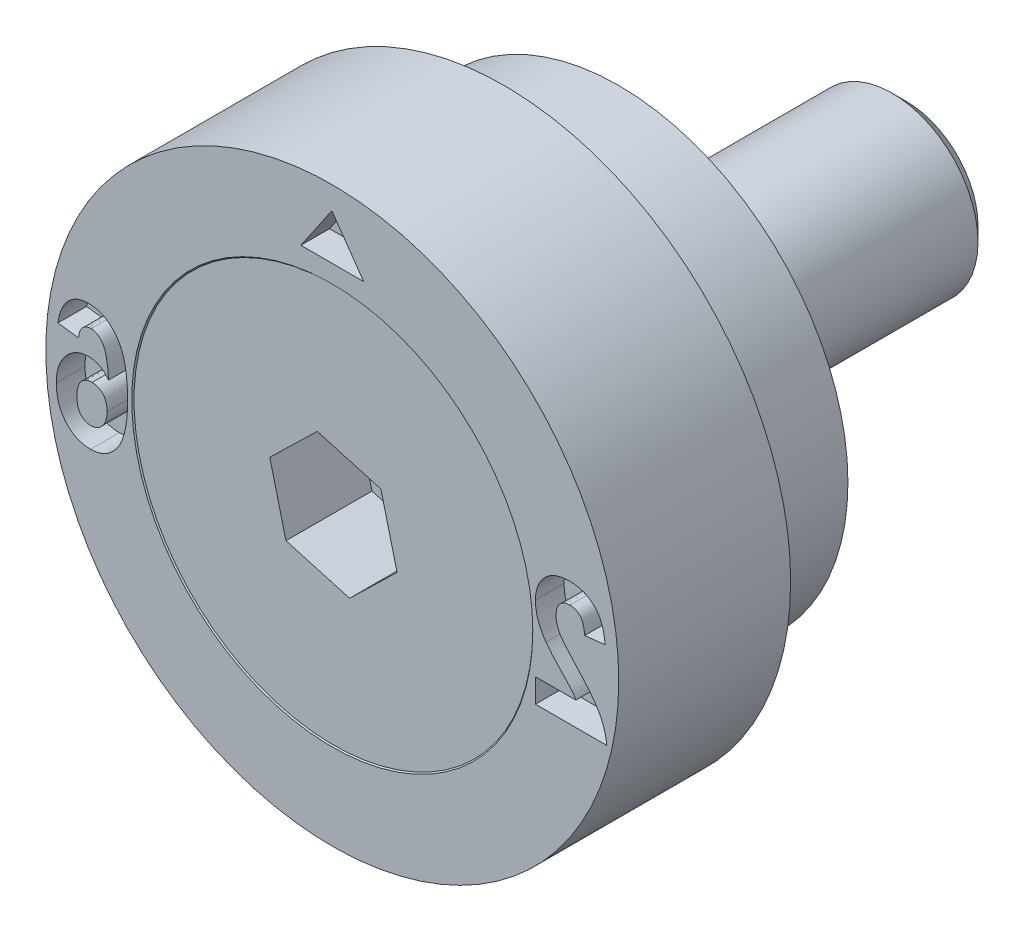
SolidWorks part; units mm, degrees
other "<M3 X .5 FHCS>-<Imported1>"
ref_plane "Front Plane" through (0, 0, 0) normal (0, 0, 1) x (1, 0, 0)
ref_plane "Top Plane" through (0, 0, 0) normal (0, 1, 0) x (1, 0, 0)
ref_plane "Right Plane" through (0, 0, 0) normal (1, 0, 0) x (0, 0, -1)
imported_body "Imported1"
sketch "Sketch1" plane through (0, 0, 0) normal (0, 0, 1) x (1, 0, 0)
  text T0 "2            6" font "Arial" height 2.159
  dimension "D1" = 1.0795
  dimension "D2" = 4.9022
extrude "Cut-Extrude1" cut sketch "Sketch1" against normal blind 0.5
inserted part "M3 X .5 FHCS"
move or copy body "Body-Move/Copy2" placed by mates yes
